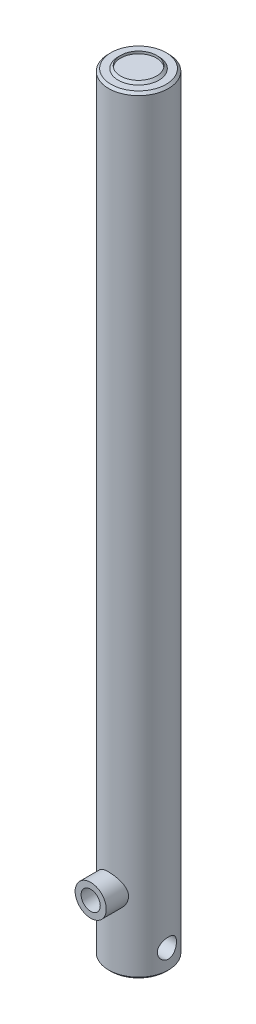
SolidWorks part; units mm, degrees
ref_plane "Plan de face" through (0, 0, 0) normal (0, 0, 1) x (1, 0, 0)
ref_plane "Plan de dessus" through (0, 0, 0) normal (0, 1, 0) x (1, 0, 0)
ref_plane "Plan de droite" through (0, 0, 0) normal (1, 0, 0) x (0, 0, -1)
sketch "Esquisse1" plane through (0, 0, 0) normal (0, 1, 0) x (1, 0, 0)
  circle A0 centre (0, 0) radius 25
  dimension "D1" = 50
extrude "Extrusion1" add sketch "Esquisse1" along normal blind 642
sketch "Esquisse2" plane through (0, 0, 0) normal (0, 0, 1) x (1, 0, 0)
  circle A0 centre (0, 60) radius 13
  circle A1 centre (0, 60) radius 8
  dimension "D2" = 26
  dimension "D3" = 5
  dimension "D1" = 60
extrude "Extrusion2" add sketch "Esquisse2" along normal blind 40
sketch "Esquisse3" plane through (0, 0, 0) normal (1, 0, 0) x (0, 0, -1)
  circle A0 centre (0, 18) radius 8
  dimension "D2" = 16
  dimension "D1" = 18
extrude "Enlèv. mat.-Extru.1" cut sketch "Esquisse3" against normal through all and the other way through all
chamfer "Chanfrein1" distance 2 angle 45 2 edges at (0, 642, 25) (0, 0, 25)
ref_axis "Axe1" through (0, -32.2, 0) along (0, 1, 0)
sketch "Esquisse4" plane through (0, 0, 0) normal (1, 0, 0) x (0, 0, -1)
  line L0 (15, 642) -> (15, 644)
  line L1 (23, 642) -> (-23, 642) construction
  line L2 (15, 644) -> (17, 642)
  line L3 (17, 642) -> (15, 642)
  dimension "D1" = 15
  dimension "D2" = 2
  dimension "D3" = 45
revolve "Révolution1" add sketch "Esquisse4" angle 360 about axis through (0, -32.2, 0) along (0, 1, 0)
